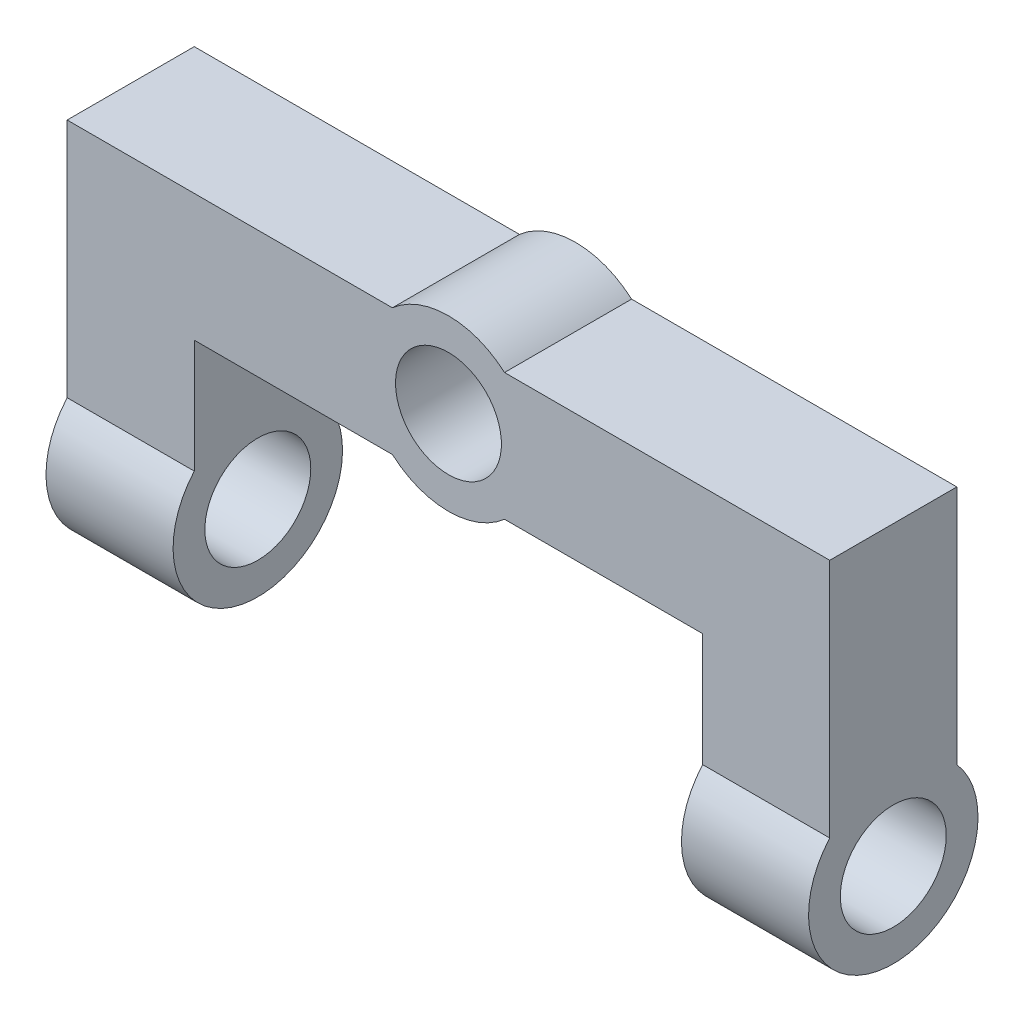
SolidWorks part; units mm, degrees
ref_plane "Plan de face" through (0, 0, 0) normal (0, 0, 1) x (1, 0, 0)
ref_plane "Plan de dessus" through (0, 0, 0) normal (0, 1, 0) x (1, 0, 0)
ref_plane "Plan de droite" through (0, 0, 0) normal (1, 0, 0) x (0, 0, -1)
sketch "Esquisse1" plane through (0, 0, 0) normal (0, 0, 1) x (1, 0, 0)
  line L0 (0, 0) -> (0, 14)
  line L1 (0, 14) -> (36, 14)
  line L2 (36, 14) -> (36, 0)
  line L3 (36, 0) -> (30, 0)
  line L4 (30, 0) -> (30, 8)
  line L5 (30, 8) -> (6, 8)
  line L6 (6, 8) -> (6, 0)
  line L7 (6, 0) -> (0, 0)
  dimension "D1" = 24
  dimension "D2" = 36
  dimension "D3" = 6
  dimension "D4" = 6
  dimension "D5" = 8
  dimension "D6" = 8
extrude "Extrusion1" add sketch "Esquisse1" along normal blind 6
sketch "Esquisse2" plane through (36, 0, 0) normal (1, 0, 0) x (0, 0, -1)
  line L0 (-6, 0) -> (0, 0) construction
  circle A0 centre (-3, 0) radius 4
  dimension "D1" = 8
extrude "Extrusion2" add sketch "Esquisse2" against normal blind 6
sketch "Esquisse3" plane through (0, 0, 0) normal (-1, 0, 0) x (0, 0, 1)
  line L0 (6, 0) -> (0, 0) construction
  circle A0 centre (3, 0) radius 4
  dimension "D1" = 8
extrude "Extrusion3" add sketch "Esquisse3" against normal blind 6
sketch "Esquisse4" plane through (0, 0, 0) normal (0, 0, -1) x (-1, 0, 0)
  line L0 (-36, 2.6458) -> (-36, 14) construction
  line L1 (-6, 8) -> (-30, 8) construction
  circle A0 centre (-18, 11) radius 4
  dimension "D3" = 8
  dimension "D1" = 18
  dimension "D2" = 3
extrude "Extrusion4" add sketch "Esquisse4" against normal blind 6
sketch "Esquisse5" plane through (0, 0, 0) normal (0, 0, -1) x (-1, 0, 0)
  circle A0 centre (-18, 11) radius 2.5
  arc A1 (-20.6458, 8) -> (-15.3542, 8) centre (-18, 11) ccw construction
  dimension "D1" = 5
extrude "Enlèv. mat.-Extru.1" cut sketch "Esquisse5" against normal through all
sketch "Esquisse6" plane through (36, 0, 0) normal (1, 0, 0) x (0, 0, -1)
  circle A0 centre (-3, 0) radius 2.5
  arc A1 (-6, 2.6458) -> (0, 2.6458) centre (-3, 0) ccw construction
  dimension "D1" = 5
extrude "Enlèv. mat.-Extru.2" cut sketch "Esquisse6" against normal through all
